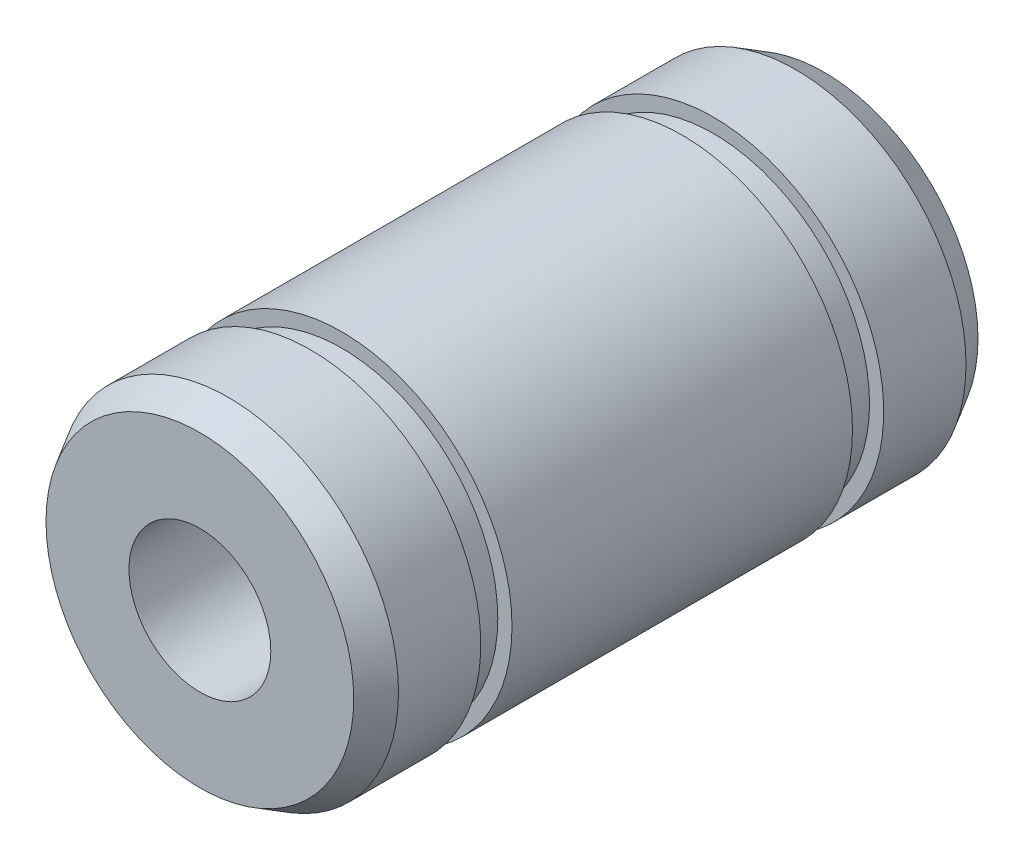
SolidWorks part; units mm, degrees
ref_plane "Plan de face" through (0, 0, 0) normal (0, 0, 1) x (1, 0, 0)
ref_plane "Plan de dessus" through (0, 0, 0) normal (0, 1, 0) x (1, 0, 0)
ref_plane "Plan de droite" through (0, 0, 0) normal (1, 0, 0) x (0, 0, -1)
sketch "Esquisse1" plane through (0, 0, 0) normal (0, 0, 1) x (1, 0, 0)
  circle A0 centre (0, 0) radius 2.5
  circle A1 centre (0, 0) radius 6
  dimension "D1" = 5
  dimension "D2" = 12
extrude "Extrusion1" add sketch "Esquisse1" along normal blind 11
chamfer "Chanfrein1" distance 1 angle 30 1 edges at (6, 0, 11)
sketch "Esquisse2" plane through (0, 0, 0) normal (1, 0, 0) x (0, 0, -1)
  line L1 (-7.1, 5.5) -> (-6, 5.5)
  line L2 (-7.1, 5.5) -> (-7.1, 15.5)
  line L3 (-7.1, 15.5) -> (-6, 15.5)
  line L4 (-6, 5.5) -> (-6, 15.5)
  dimension "D1" = 1.1
  dimension "D2" = 10
  dimension "D3" = 5.5
  dimension "D4" = 6
revolve "Enlèvement de matière-Révolution1" cut sketch "Esquisse2" angle 360 about axis through (0, 0, 11) along (0, 0, -1)
mirror "Symétrie1" about plane through (0, 0, 0) normal (0, 0, 1)
